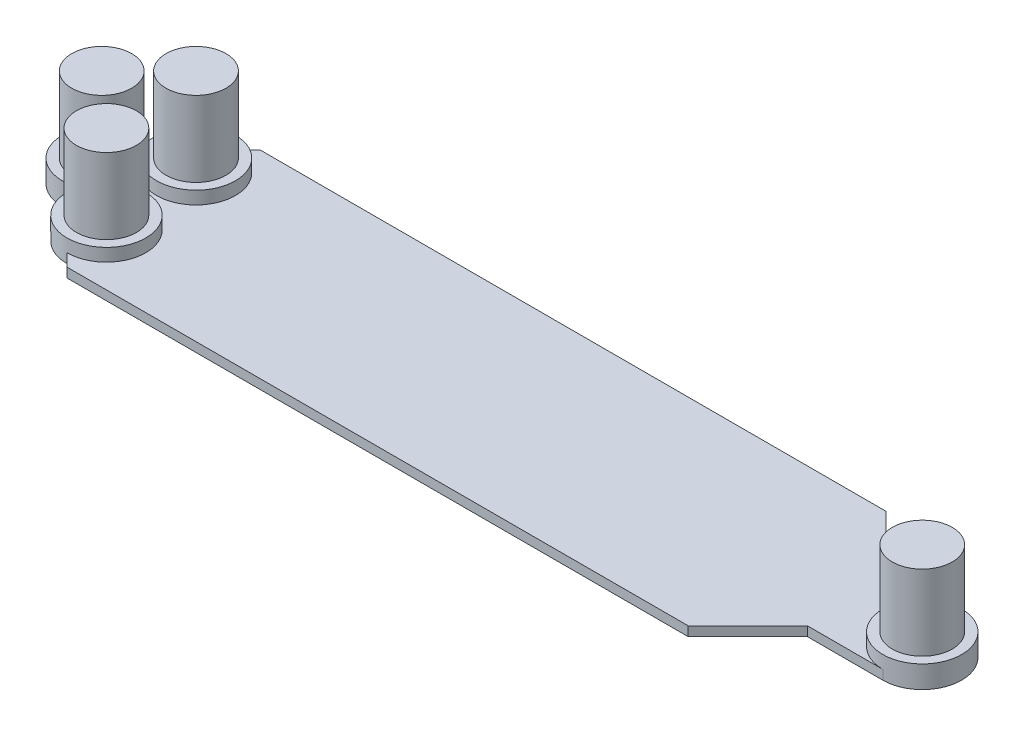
SolidWorks part; units mm, degrees
ref_plane "Front Plane" through (0, 0, 0) normal (0, 0, 1) x (1, 0, 0)
ref_plane "Top Plane" through (0, 0, 0) normal (0, 1, 0) x (1, 0, 0)
ref_plane "Right Plane" through (0, 0, 0) normal (1, 0, 0) x (0, 0, -1)
sketch "Sketch1" plane through (0, 0, 0) normal (0, 1, 0) x (1, 0, 0)
  line L0 (-41.18, -5) -> (-42.5, -4.18)
  line L1 (-42.5, 4.18) -> (-41.68, 5)
  line L2 (-37.5, 9.18) -> (-36.18, 10.5)
  line L4 (-37, -9.18) -> (-35.68, -10.5)
  line L10 (36.5, -4.18) -> (44.5, -4.18)
  line L11 (30.18, -10.5) -> (-35.68, -10.5)
  line L12 (30.18, 10.5) -> (-36.18, 10.5)
  line L14 (-47.5, 0) -> (64.1584, 0) construction
  line L15 (44.5, 4.18) -> (36.5, 4.18)
  line L18 (36.5, -4.18) -> (30.18, -10.5)
  line L19 (36.5, 4.18) -> (30.18, 10.5)
  arc A0 (44.5, 4.18) -> (44.5, -4.18) centre (44.5, 0) cw
  arc A1 (-42.5, 4.18) -> (-42.5, -4.18) centre (-42.5, 0) ccw
  arc A3 (-41.68, 5) -> (-37.5, 9.18) centre (-37.5, 5) cw
  arc A6 (-41.18, -5) -> (-37, -9.18) centre (-37, -5) ccw
  point P0 (0, 0)
  point P8 (1, -2.5)
  dimension "D7" = 10.5
extrude "Boss-Extrude1" add sketch "Sketch1" along normal blind 1
sketch "buffer channel" plane through (0, 1, 0) normal (0, 1, 0) x (1, 0, 0)
  line L0 (-41.5, 0) -> (43.5, 0)
  circle A1 centre (-42.5, 0) radius 1
  circle A3 centre (44.5, 0) radius 1
  dimension "D3" = 2
  dimension "D4" = 2
  dimension "D8" = 85
sketch "Sketch4" plane through (0, 1, 0) normal (0, 1, 0) x (1, 0, 0)
  line L3 (-39.3182, 0.4435) -> (-42.2804, 4.1742)
  line L4 (-41.5195, -4.0634) -> (-39.3182, -0.7015)
  line L5 (-39.3182, -0.7015) -> (-39.3182, 0.4435)
  circle A4 centre (-37, -5) radius 4.18
  circle A5 centre (44.5, 0) radius 4.18
  circle A6 centre (-37.5, 5) radius 4.18
  arc A7 (-42.2804, 4.1742) -> (-41.5195, -4.0634) centre (-42.5, 0) ccw
extrude "Boss-Extrude2" add sketch "Sketch4" along normal blind 1.36
sketch "Sketch5" plane through (0, 2.36, 0) normal (0, 1, 0) x (1, 0, 0)
  circle A0 centre (-37.5, 5) radius 3.18
  circle A1 centre (-42.5, 0) radius 3.18
  circle A2 centre (-37, -5) radius 3.18
  circle A3 centre (44.5, 0) radius 3.18
extrude "Boss-Extrude3" add sketch "Sketch5" along normal blind 8
sketch "sample channel" plane through (0, 0, 0) normal (0, 1, 0) x (1, 0, 0)
  line L1 (-37.5, 4) -> (-37.5, 0)
  line L3 (-37, 0) -> (-37, -4)
  circle A0 centre (-37.5, 5) radius 1
  circle A2 centre (-37, -5) radius 1
  dimension "D1" = 2
  dimension "D2" = 2
  dimension "D6" = 0.5
